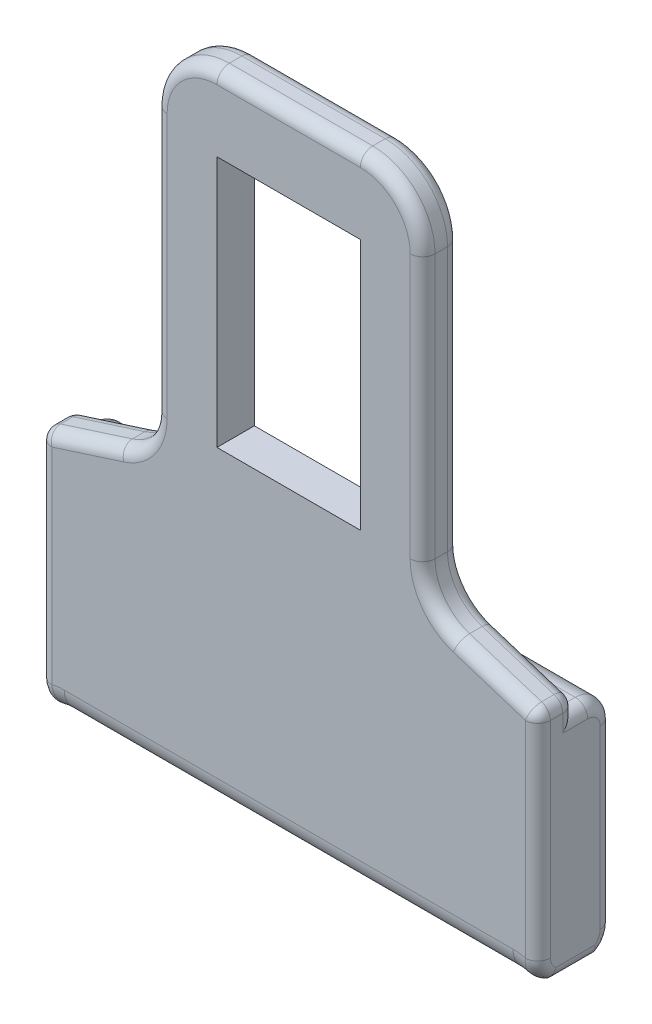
SolidWorks part; units mm, degrees
ref_plane "Ön Düzlem" through (0, 0, 0) normal (0, 0, 1) x (1, 0, 0)
ref_plane "Üst Düzlem" through (0, 0, 0) normal (0, 1, 0) x (1, 0, 0)
ref_plane "Sağ Düzlem" through (0, 0, 0) normal (1, 0, 0) x (0, 0, -1)
sketch "Çizim1" plane through (0, 0, 0) normal (0, 0, 1) x (1, 0, 0)
  line L0 (5.75, 0) -> (-5.75, 0)
  line L1 (-10.75, -5) -> (-10.75, -26.1903)
  line L2 (-13.5308, -30) -> (-23.5, -33.1903)
  line L3 (-23.5, -33.1903) -> (-23.5, -63.1903)
  line L4 (-23.5, -63.1903) -> (23.5, -63.1903)
  line L5 (0, 0) -> (0, 13.8791) construction
  line L6 (23.5, -33.1903) -> (23.5, -63.1903)
  line L7 (13.5308, -30) -> (23.5, -33.1903)
  line L8 (10.75, -5) -> (10.75, -26.1903)
  line L9 (5.75, -6) -> (-5.75, -6)
  line L10 (-5.75, -6) -> (-5.75, -26.2)
  line L11 (5.75, -6) -> (5.75, -26.2)
  line L12 (-5.75, 0) -> (-5.75, -30.3054) construction
  line L13 (10.75, -6) -> (-10.75, -6) construction
  line L14 (5.75, 0) -> (5.75, -30.3054) construction
  line L15 (5.75, -26.2) -> (-5.75, -26.2)
  line L16 (10.75, 0) -> (10.75, -30.3054) construction
  line L17 (-10.75, 0) -> (-10.75, -30.3054) construction
  line L18 (10.75, 0) -> (-10.75, 0) construction
  arc A0 (13.5308, -30) -> (10.75, -26.1903) centre (14.75, -26.1903) cw
  arc A1 (-13.5308, -30) -> (-10.75, -26.1903) centre (-14.75, -26.1903) ccw
  arc A2 (10.75, -5) -> (5.75, 0) centre (5.75, -5) ccw
  arc A3 (-10.75, -5) -> (-5.75, 0) centre (-5.75, -5) cw
  point P4 (0, 0)
  point P26 (10.75, -29.1101)
  point P30 (-10.75, -29.1101)
  dimension "D6" = 4
  dimension "D10" = 5
  dimension "D7" = 30
  dimension "D8" = 47
  dimension "D9" = 7
  dimension "D11" = 21.5
  dimension "D12" = 30
  dimension "D2" = 6
  dimension "D3" = 5
  dimension "D4" = 5
  dimension "D5" = 20.2
extrude "Yükseklik-Ekstrüzyon1" add sketch "Çizim1" along normal blind 3
sketch "Çizim2" plane through (0, 0, 3) normal (0, 0, 1) x (1, 0, 0)
  line L0 (0, 0) -> (0, -58.1903) construction
  line L2 (-30, -33.1903) -> (30, -33.1903)
  line L3 (-35, -38.1903) -> (-35, -78.1903)
  line L4 (-30, -83.1903) -> (30, -83.1903)
  line L5 (35, -38.1903) -> (35, -78.1903)
  line L6 (-35, -33.1903) -> (35, -83.1903) construction
  line L7 (-35, -83.1903) -> (35, -33.1903) construction
  line L8 (-13.5308, -30) -> (-23.5, -33.1903) construction
  line L9 (-13.5308, -30) -> (-23.5, -33.1903) construction
  arc A0 (30, -83.1903) -> (35, -78.1903) centre (30, -78.1903) ccw
  arc A1 (-35, -78.1903) -> (-30, -83.1903) centre (-30, -78.1903) ccw
  arc A2 (30, -33.1903) -> (35, -38.1903) centre (30, -38.1903) cw
  arc A3 (-30, -33.1903) -> (-35, -38.1903) centre (-30, -38.1903) ccw
  dimension "D3" = 5
  dimension "D1" = 70
  dimension "D2" = 50
extrude "Yükseklik-Ekstrüzyon2" add sketch "Çizim2" against normal blind 6
fillet "Radyus1" radius 2 8 edges at (33.5355, -34.6548, -3) (35, -58.1903, -3) (33.5355, -81.7259, -3) (0, -83.1903, -3) (-33.5355, -81.7259, -3) (-35, -58.1903, -3) (-33.5355, -34.6548, -3) (0, -33.1903, -3)
fillet "Radyus2" [suppressed] radius 1
fillet "Radyus3" [suppressed] radius 2
sketch "Çizim3" plane through (0, 0, -3) normal (0, 0, -1) x (-1, 0, 0)
  line L0 (0, 0) -> (0, -63.6903) construction
  line L1 (30, -83.1903) -> (-30, -83.1903) construction
  line L2 (-20, -76.1903) -> (20, -76.1903)
  line L3 (-20, -76.1903) -> (-20, -51.1903)
  line L4 (-20, -51.1903) -> (20, -51.1903)
  line L5 (20, -76.1903) -> (20, -51.1903)
  line L6 (-20, -76.1903) -> (20, -51.1903) construction
  line L7 (-20, -51.1903) -> (20, -76.1903) construction
  dimension "D1" = 40
  dimension "D2" = 25
  dimension "D3" = 7
extrude "Kes-Ekstrüzyon1" cut sketch "Çizim3" against normal through all
fillet "Radyus4" radius 2 12 edges at (20, -63.6903, 3) (20, -63.6903, -3) (-20, -63.6903, 3) (-20, -63.6903, -3) (-20, -51.1903, 0) (0, -51.1903, 3) (20, -51.1903, 0) (0, -51.1903, -3) (20, -76.1903, 0) (0, -76.1903, 3) (-20, -76.1903, 0) (0, -76.1903, -3)
sketch "Çizim4" plane through (0, 0, -3) normal (0, 0, -1) x (-1, 0, 0)
  line L0 (-20, -51.1903) -> (-20, -25.2644)
  line L1 (-20, -53.1903) -> (-20, -74.1903) construction
  line L2 (-20, -25.2644) -> (-42.4028, -25.2644)
  line L3 (-42.4028, -25.2644) -> (-42.4028, -87.7225)
  line L4 (-42.4028, -87.7225) -> (38.6209, -87.7225)
  line L5 (38.6209, -87.7225) -> (38.6209, -25.2644)
  line L6 (38.6209, -25.2644) -> (20, -25.2644)
  line L7 (20, -25.2644) -> (20, -51.1903)
  line L8 (20, -51.1903) -> (-20, -51.1903)
  line L9 (18, -51.1903) -> (-18, -51.1903) construction
extrude "Kes-Ekstrüzyon2" cut sketch "Çizim4" against normal through all
fillet "Radyus5" radius 1 36 edges at (16.7654, -31.0351, 3) (11.5192, -28.5486, 3) (10.75, -15.5952, 3) (9.2855, -1.4645, 3) (0, 0, 3) (-9.2855, -1.4645, 3) (-16.7654, -31.0351, 3) (-11.5192, -28.5486, 3) (16.7654, -31.0351, 0) (11.5192, -28.5486, 0) (10.75, -15.5952, 0) (9.2855, -1.4645, 0) (0, 0, 0) (-16.7654, -31.0351, 0) (-11.5192, -28.5486, 0) (-10.75, -15.5952, 0) (20, -32.0703, 1.5) (20, -32.6303, 0) (20, -33.1903, -0.5) (20, -33.7761, -2.4142) (20, -42.4583, -3) (20, -51.1903, 0) (20, -50.2673, 2.9468) (20, -40.8982, 3) (-20, -32.0703, 1.5) (-20, -40.8982, 3) (-20, -50.2673, 2.9468) (-20, -51.1903, 0) (-20, -42.4583, -3) (-20, -33.7761, -2.4142) (-20, -33.1903, -0.5) (-20, -32.6303, 0) (-10.75, -15.5952, 3) (-9.2855, -1.4645, 0)
